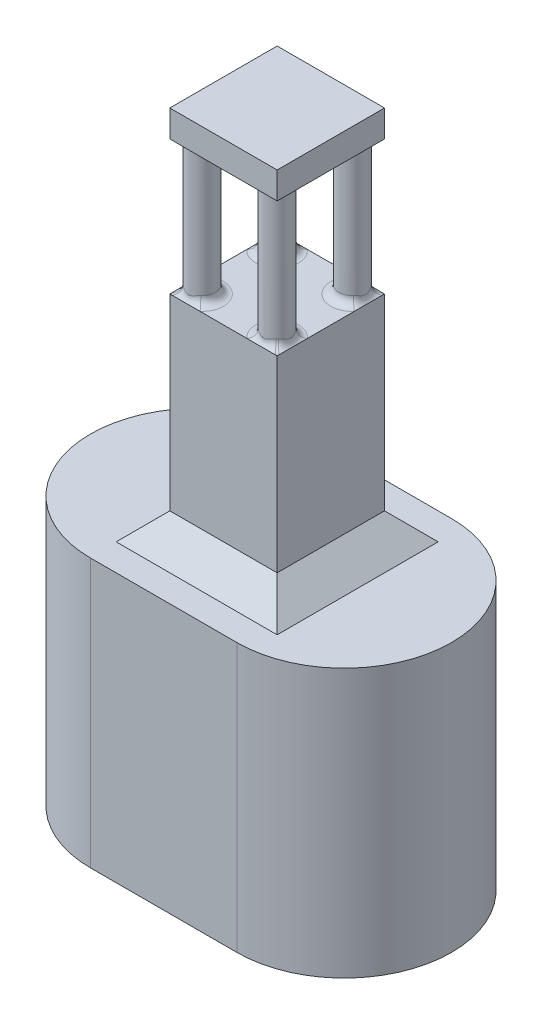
SolidWorks part; units mm, degrees
ref_plane "前视基准面" through (0, 0, 0) normal (0, 0, 1) x (1, 0, 0)
ref_plane "上视基准面" through (0, 0, 0) normal (0, 1, 0) x (1, 0, 0)
ref_plane "右视基准面" through (0, 0, 0) normal (1, 0, 0) x (0, 0, -1)
other "Configuration Table"
sketch "草图1" plane through (0, 0, 0) normal (0, 1, 0) x (1, 0, 0)
  line L1 (250, -150) -> (-250, -150)
  line L2 (250, -150) -> (250, 150)
  line L3 (250, 150) -> (-250, 150)
  line L4 (-250, -150) -> (-250, 150)
  line L5 (250, -150) -> (-250, 150) construction
  line L6 (250, 150) -> (-250, -150) construction
  point P0 (0, 0)
  dimension "D1" = 500
  dimension "D2" = 300
extrude "凸台-拉伸1" add sketch "草图1" along normal blind 20
sketch "草图2" plane through (0, 0, 150) normal (0, 0, 1) x (1, 0, 0)
  line L0 (180, 0) -> (180, -19.9739)
  line L1 (-250, 0) -> (250, 0) construction
  line L2 (180, -19.9739) -> (220, -19.9739)
  line L3 (220, -19.9739) -> (220, 0)
  line L4 (220, 0) -> (180, 0)
  line L5 (250, 20) -> (250, 0) construction
  line L6 (180, -19.9739) -> (220, -19.9739)
  arc A0 (180, -19.9739) -> (220, -19.9739) centre (200, -19.9739) ccw
  circle A1 centre (200, -19.9739) radius 10
  dimension "D3" = 20
  dimension "D1" = 40
  dimension "D2" = 30
extrude "凸台-拉伸2" add sketch "草图2" against normal blind 10 contours L2 L3 L0 M5 | L2 A0
fillet "圆角1" radius 10 4 edges at (-250, 10, 150) (-250, 10, -150) (250, 10, -150) (250, 10, 150)
fillet "圆角2" radius 10 2 edges at (180, 0, 145) (220, 0, 145)
pattern_linear "阵列(线性)2" count 2 spacing 290 along (0, 0, -1) of "凸台-拉伸2"
pattern_linear "阵列(线性)3" count 2 spacing 410 along (-1, 0, 0) of "凸台-拉伸2"
pattern_linear "阵列(线性)5" count 2 spacing 290 along (0, 0, -1) of "阵列(线性)3"
fillet "圆角3" radius 10 6 edges at (220, 0, -145) (180, 0, -145) (-230, 0, -145) (-190, 0, -145) (-190, 0, 145) (-230, 0, 145)
sketch "草图5" plane through (0, 20, 0) normal (0, 1, 0) x (1, 0, 0)
  circle A1 centre (131.1463, 50) radius 5
  circle A2 centre (174.4476, 25) radius 5
  circle A3 centre (174.4476, -25) radius 5
  circle A4 centre (131.1463, -50) radius 5
  circle A5 centre (87.8451, -25) radius 5
  circle A6 centre (87.8451, 25) radius 5
  point P0 (131.1463, 0)
  dimension "D1" = 6
  dimension "10" = 10
extrude "切除-拉伸1" cut sketch "草图5" against normal through all
sketch "草图6" plane through (0, 20, 0) normal (0, 1, 0) x (1, 0, 0)
  line L0 (-180, 0) -> (-125.4153, 0) construction
  line L1 (-180, 40) -> (-125.4153, 40)
  line L2 (-180, -40) -> (-125.4153, -40)
  line L3 (-250, 140) -> (-250, -140) construction
  arc A0 (-180, 40) -> (-180, -40) centre (-180, 0) ccw
  arc A1 (-125.4153, -40) -> (-125.4153, 40) centre (-125.4153, 0) ccw
  point P3 (-152.7076, 0)
  dimension "D1" = 70
  dimension "D2" = 80
extrude "凸台-拉伸3" add sketch "草图6" along normal blind 100
sketch "草图7" plane through (0, 120, 0) normal (0, 1, 0) x (1, 0, 0)
  line L0 (-125.4153, 40) -> (-180, 40) construction
  line L1 (-130.4153, -20) -> (-170.4153, -20)
  line L2 (-130.4153, -20) -> (-130.4153, 20)
  line L3 (-130.4153, 20) -> (-170.4153, 20)
  line L4 (-170.4153, -20) -> (-170.4153, 20)
  line L5 (-130.4153, -20) -> (-170.4153, 20) construction
  line L6 (-130.4153, 20) -> (-170.4153, -20) construction
  point P0 (-150.4153, 0)
  dimension "D1" = 40
  dimension "D2" = 40
  dimension "40" = 40
  dimension "D3" = 5
extrude "凸台-拉伸4" add sketch "草图7" along normal blind 80
chamfer "倒角1" distance 10 angle 45 4 edges at (-150.4153, 120, -20) (-130.4153, 120, 0) (-170.4153, 120, 0) (-150.4153, 120, 20)
sketch "草图8" plane through (0, 200, 0) normal (0, 1, 0) x (1, 0, 0)
  line L0 (-130.4153, 20) -> (-170.4153, 20) construction
  line L1 (-170.4153, 20) -> (-170.4153, -20) construction
  circle A0 centre (-164.4153, 14) radius 5
  circle A1 centre (-136.4153, 14) radius 5
  circle A2 centre (-136.4153, -14) radius 5
  circle A3 centre (-164.4153, -14) radius 5
  dimension "D1" = 10
  dimension "D2" = 6
  dimension "D3" = 6
  dimension "D4" = 2
  dimension "D5" = 2
extrude "凸台-拉伸5" add sketch "草图8" along normal blind 50
sketch "草图9" plane through (0, 250, 0) normal (0, 1, 0) x (1, 0, 0)
  line L1 (-170.4153, 20) -> (-130.4153, 20)
  line L2 (-170.4153, 20) -> (-170.4153, -20)
  line L3 (-170.4153, -20) -> (-130.4153, -20)
  line L4 (-130.4153, 20) -> (-130.4153, -20)
extrude "凸台-拉伸6" add sketch "草图9" along normal blind 10
fillet "圆角4" radius 3 4 edges at (-164.4153, 200, -9) (-136.4153, 200, -9) (-136.4153, 200, 19) (-164.4153, 200, 19)
sketch "草图10" plane through (0, 0, 0) normal (0, 0, 1) x (1, 0, 0)
  line L1 (-350, -220) -> (350, -220)
  line L2 (-350, -220) -> (-350, 20)
  line L3 (-350, 20) -> (350, 20)
  line L4 (350, -220) -> (350, 20)
  line L5 (-350, -220) -> (350, 20) construction
  line L6 (-350, 20) -> (350, -220) construction
  point P0 (0, -100)
  dimension "D1" = 350
  dimension "D2" = 20
  dimension "D3" = 100
extrude "Separate_At_Original_Deck_Y20" cut sketch "草图10" against normal mid plane 1000
